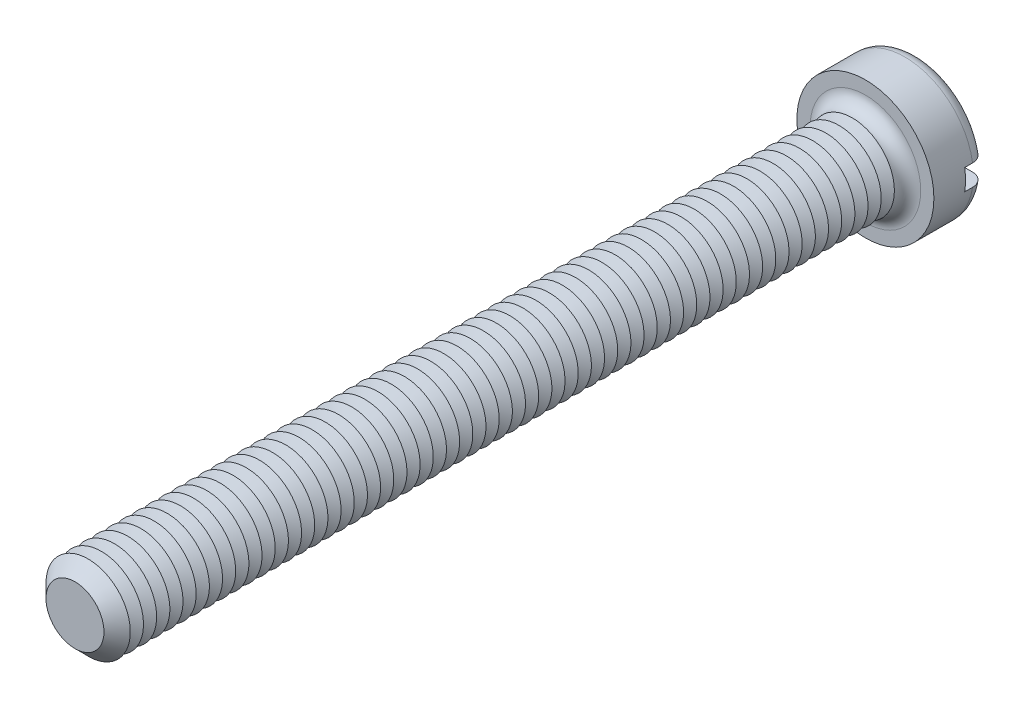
SolidWorks part; units mm, degrees
ref_plane "Front Plane" through (0, 0, 0) normal (0, 0, 1) x (1, 0, 0)
ref_plane "Top Plane" through (0, 0, 0) normal (0, 1, 0) x (1, 0, 0)
ref_plane "Right Plane" through (0, 0, 0) normal (1, 0, 0) x (0, 0, -1)
sketch "Sketch3" plane through (0, 0, 0) normal (0, 0, 1) x (1, 0, 0)
  circle A0 centre (0, 0) radius 6.5
  dimension "D1" = 13
extrude "Boss-Extrude2" add sketch "Sketch3" against normal blind 5
sketch "Sketch4" plane through (0, 0, 0) normal (0, 0, 1) x (1, 0, 0)
  circle A0 centre (0, 0) radius 4
  dimension "D1" = 8
extrude "Boss-Extrude3" add sketch "Sketch4" along normal blind 75
fillet "Fillet1" radius 1.25 2 edges at (6.5, 0, -5) (4, 0, 0)
chamfer "Chamfer1" distance 1.25 angle 45 1 edges at (4, 0, 75)
sketch "Sketch5" plane through (0, 0, 0) normal (1, 0, 0) x (0, 0, -1)
  line L0 (1.6944, 0) -> (-7.6738, 0) construction
sketch "Sketch6" plane through (0, 0, 0) normal (1, 0, 0) x (0, 0, -1)
  line L0 (-1.25, 4) -> (-1.875, 2.9175)
  line L1 (-1.875, 2.9175) -> (-2.5, 4)
  line L2 (-1.25, 4) -> (-73.75, 4) construction
  line L3 (-2.5, 4) -> (-1.25, 4)
  dimension "D1" = 1.25
revolve "Cut-Revolve1" cut sketch "Sketch6" angle 360 about L0
pattern_linear "LPattern1" count 58 spacing 1.25 along (0, 0, 1) of "Cut-Revolve1"
sketch "Sketch8" plane through (0, 0, -5) normal (0, 0, -1) x (-1, 0, 0)
  line L1 (6.5, -1) -> (-6.5, -1)
  line L2 (6.5, -1) -> (6.5, 1)
  line L3 (6.5, 1) -> (-6.5, 1)
  line L4 (-6.5, -1) -> (-6.5, 1)
  line L5 (6.5, -1) -> (-6.5, 1) construction
  line L6 (6.5, 1) -> (-6.5, -1) construction
  point P0 (0, 0)
  dimension "D1" = 13
  dimension "D2" = 2
extrude "Cut-Extrude1" cut sketch "Sketch8" against normal blind 2
